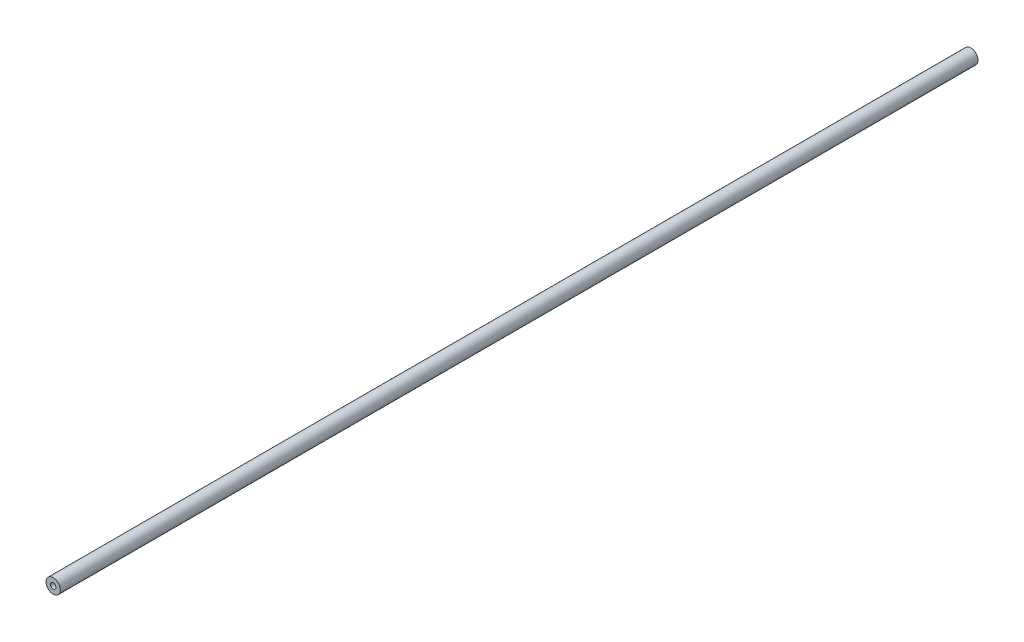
SolidWorks part; units mm, degrees
ref_plane "Front Plane" through (0, 0, 0) normal (0, 0, 1) x (1, 0, 0)
ref_plane "Top Plane" through (0, 0, 0) normal (0, 1, 0) x (1, 0, 0)
ref_plane "Right Plane" through (0, 0, 0) normal (1, 0, 0) x (0, 0, -1)
sketch "Sketch1" plane through (0, 0, 0) normal (0, 0, 1) x (1, 0, 0)
  circle A0 centre (0, 0) radius 4.7625
  circle A1 centre (0, 0) radius 1.8415
  dimension "D1" = 9.525
  dimension "D2" = 2.921
extrude "Boss-Extrude1" add sketch "Sketch1" along normal blind 609.6
